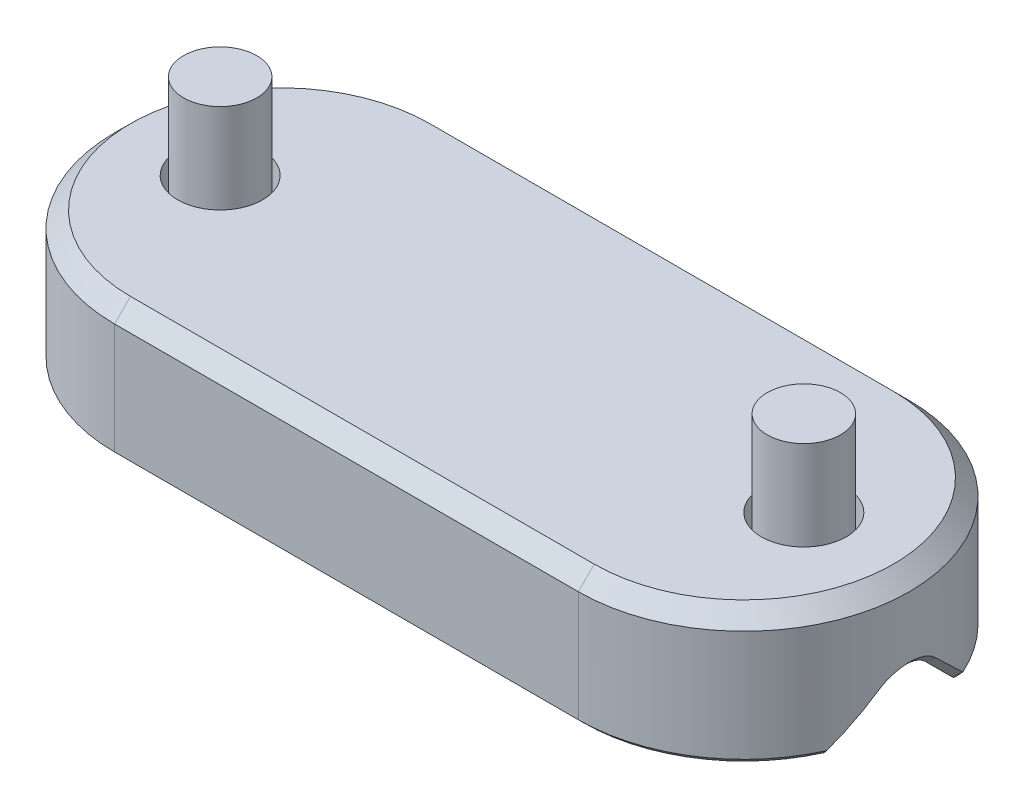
SolidWorks part; units mm, degrees
other "<SHCS6-32L.25>-<HEX>"
ref_plane "Front Plane" through (0, 0, 0) normal (0, 0, 1) x (1, 0, 0)
ref_plane "Top Plane" through (0, 0, 0) normal (0, 1, 0) x (1, 0, 0)
ref_plane "Right Plane" through (0, 0, 0) normal (1, 0, 0) x (0, 0, -1)
sketch "Sketch1" plane through (0, 0, 0) normal (0, 1, 0) x (1, 0, 0)
  line L0 (-11.0998, 0) -> (11.0998, 0) construction
  line L1 (-11.0998, 7.9248) -> (11.0998, 7.9248)
  line L2 (-11.0998, -7.9248) -> (11.0998, -7.9248)
  line L6 (0, 7.9248) -> (0, -7.9248) construction
  arc A0 (-11.0998, 7.9248) -> (-11.0998, -7.9248) centre (-11.0998, 0) ccw
  arc A1 (11.0998, -7.9248) -> (11.0998, 7.9248) centre (11.0998, 0) ccw
  circle A2 centre (-13.97, 0) radius 2.032
  circle A3 centre (13.97, 0) radius 2.032
  point P2 (0, 0)
  dimension "D2" = 38.0492
  dimension "D3" = 4.064
  dimension "D4" = 27.94
  dimension "D7" = 7.9248
  dimension "D8" = 19.0246
  dimension "D9" = 19.0246
  dimension "D1" = 15.8496
extrude "Boss-Extrude1" add sketch "Sketch1" along normal blind 6.3246
sketch "Sketch3" plane through (0, 0, 0) normal (0, 1, 0) x (1, 0, 0)
  line L0 (-13.97, 0) -> (13.97, 0) construction
  circle A0 centre (-13.97, 0) radius 3.175
  circle A1 centre (13.97, 0) radius 3.175
  dimension "D1" = 6.35
extrude "Cut-Extrude2" cut sketch "Sketch3" along normal blind 4.064
sketch "Sketch2" plane through (0, 0, 0) normal (1, 0, 0) x (0, 0, -1)
  line L6 (-3.0504, 0) -> (3.0504, 0)
  line L7 (-7.9248, 0) -> (7.9248, 0) construction
  line L15 (0, 7.9902) -> (0, -1.8378) construction
  line L16 (3.0504, 0) -> (1.1315, 1.9189)
  line L17 (-1.1315, 1.9189) -> (-3.0504, 0)
  line L18 (7.9248, 6.3246) -> (-7.9248, 6.3246) construction
  arc A5 (1.1315, 1.9189) -> (-1.1315, 1.9189) centre (0, 0.7874) ccw
  circle A6 centre (0, -1.1883) radius 2.9972 construction
  point P15 (0, 3.2742)
  dimension "D6" = 90
  dimension "D9" = 5.9944
  dimension "D4" = 1.6002
  dimension "D1" = 5.5372
extrude "Cut-Extrude1" cut sketch "Sketch2" against normal mid plane 50.8
fillet "Fillet1" radius 0.254 6 edges at (0, 0, -3.0504) (0, 0, 3.0504) (16.6323, 0, 3.0504) (16.6323, 0, -3.0504) (-16.6323, 0, -3.0504) (-16.6323, 0, 3.0504)
chamfer "Chamfer1" distance 0.254 angle 45 12 edges at (0, 0, 7.9248) (-15.4469, 0, -6.6261) (-15.4469, 0, 6.6261) (0, 0, -7.9248) (15.4469, 0, -6.6261) (-18.7498, 0.9816, -2.0689) (18.7498, 0.9816, -2.0689) (-19.0226, 2.3777, -0.1776) (19.0226, 2.3777, 0.1776) (-18.7498, 0.9816, 2.0689) (18.7498, 0.9816, 2.0689) (15.4469, 0, 6.6261)
chamfer "Chamfer2" distance 0.762 angle 45 4 edges at (0, 6.3246, -7.9248) (-19.0246, 6.3246, 0) (19.0246, 6.3246, 0) (0, 6.3246, 7.9248)
inserted part "SHCS6-32L.25"
move or copy body "Body-Move/Copy2" placed by mates yes parameters "D1"=0, "D2"=0, "D3"=0
mirror "Mirror1" about plane through (0, 0, 0) normal (1, 0, 0)
